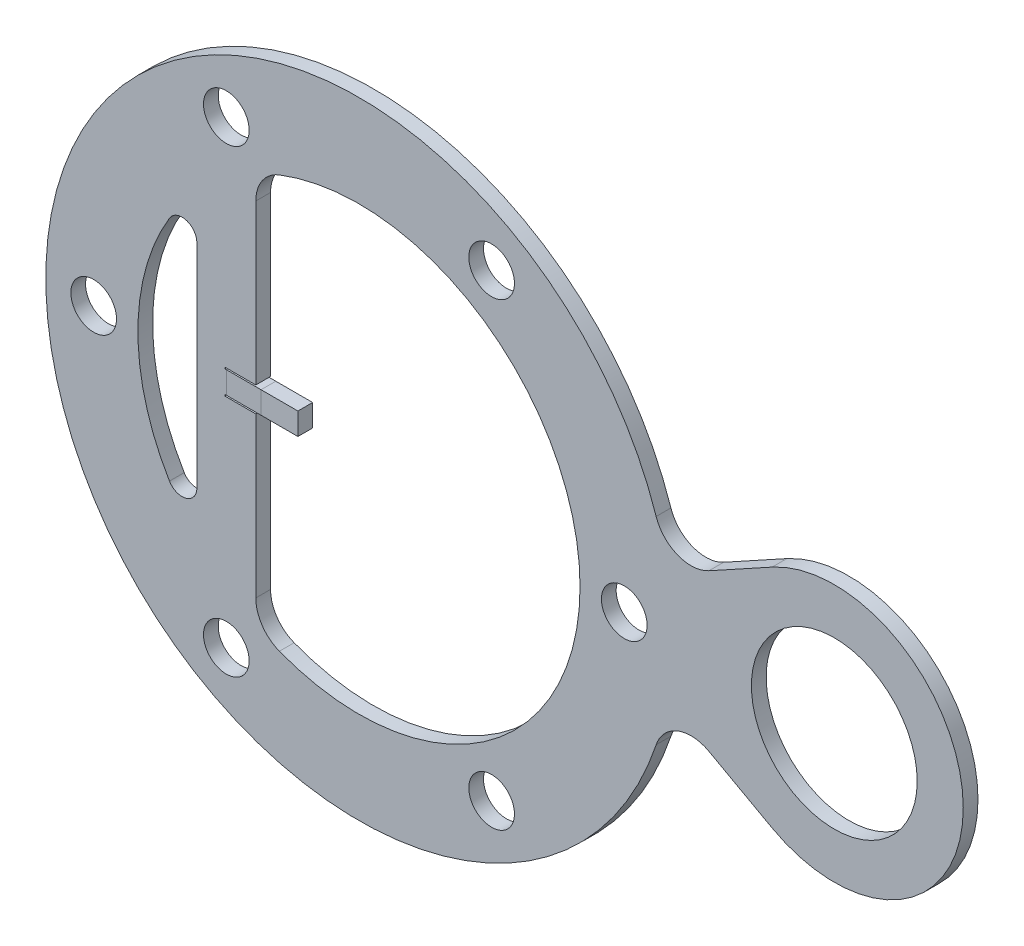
SolidWorks part; units mm, degrees
ref_plane "Plan1" through (0, 0, 0) normal (0, 0, 1) x (1, 0, 0)
ref_plane "Plan2" through (0, 0, 0) normal (0, 1, 0) x (1, 0, 0)
ref_plane "Plan3" through (0, 0, 0) normal (1, 0, 0) x (0, 0, -1)
sketch "Esquisse1" plane through (0, 0, 0) normal (0, 0, 1) x (1, 0, 0)
  line L0 (-17.0165, 10.6099) -> (-8.438, 15.3313)
  line L1 (-17.0165, -10.6099) -> (-8.438, -15.3313)
  line L2 (-64.5, 0) -> (0, 0) construction
  line L3 (-64.5, 0) -> (-82.5, 31.1769) construction
  line L4 (-64.5, 0) -> (-82.5, -31.1769) construction
  line L5 (-78.5, 23.3238) -> (-78.5, -23.3238)
  line L6 (-86.5, 14.4222) -> (-86.5, -14.4222)
  line L7 (-82.5, 31.1769) -> (-82.5, -31.1769) construction
  line L8 (-64.5, 8.641) -> (-64.5, -8.641) construction
  arc A0 (-8.438, -15.3313) -> (-8.438, 15.3313) centre (0, 0) ccw
  arc A1 (-24.1719, 13.4124) -> (-83.7667, -37.882) centre (-64.5, 0) ccw
  circle A2 centre (0, 0) radius 11.25
  circle A3 centre (-28.5, 0) radius 3.1
  arc A4 (-75.3, -27.9886) -> (-75.3, 27.9886) centre (-64.5, 0) ccw
  arc A5 (-17.0165, 10.6099) -> (-24.1719, 13.4124) centre (-19.4274, 14.9903) cw
  arc A6 (-24.1719, -13.4124) -> (-17.0165, -10.6099) centre (-19.4274, -14.9903) cw
  circle A7 centre (-64.5, 0) radius 36 construction
  circle A8 centre (-82.5, 31.1769) radius 3.1
  circle A9 centre (-82.5, -31.1769) radius 3.1
  arc A10 (-83.7667, -37.882) -> (-24.1719, -13.4124) centre (-64.5, 0) ccw
  arc A11 (-75.3, 27.9886) -> (-78.5, 23.3238) centre (-73.5, 23.3238) ccw
  arc A12 (-75.3, -27.9886) -> (-78.5, -23.3238) centre (-73.5, -23.3238) cw
  arc A13 (-86.5, 14.4222) -> (-90.2143, 15.4524) centre (-88.5, 14.4222) ccw
  arc A14 (-86.5, -14.4222) -> (-90.2143, -15.4524) centre (-88.5, -14.4222) cw
  circle A15 centre (-46.5, -31.1769) radius 3.1
  circle A16 centre (-46.5, 31.1769) radius 3.1
  arc A17 (-90.2143, 15.4524) -> (-90.2143, -15.4524) centre (-64.5, 0) ccw
  circle A18 centre (-100.5, 0) radius 3.1
  point P13 (-22.667, 7.5)
  point P16 (-22.667, -7.5)
  point P31 (-86.5, -36.3628)
  dimension "D1" = 35
  dimension "D2" = 22.5
  dimension "D3" = 85
  dimension "D4" = 6.2
  dimension "D8" = 60
  dimension "D9" = 5
  dimension "D11" = 5
  dimension "D13" = 2
  dimension "D5" = 28.5
  dimension "D6" = 15
  dimension "D7" = 64.5
  dimension "D10" = 120
  dimension "D12" = 8
extrude "Base-Extrusion" add sketch "Esquisse1" along normal blind 2
sketch "Esquisse2" plane through (0, 0, 2) normal (0, 0, 1) x (1, 0, 0)
  line L0 (-93.3693, 0) -> (-63.5087, 0) construction
  line L1 (-78.5, 23.3238) -> (-78.5, -23.3238) construction
  line L2 (-80.5, 1.5) -> (-78.5, 1.5)
  line L3 (-80.5, 1.5) -> (-80.5, -1.5)
  line L4 (-80.5, -1.5) -> (-78.5, -1.5)
  line L5 (-78.5, 1.5) -> (-78.5, -1.5)
  dimension "D1" = 3
  dimension "D2" = 2
extrude "Boss.-Extru.1" add sketch "Esquisse2" along normal blind 7
sheet metal parameters "Tôlerie 4" parameters "D1"=2
bend "Pli dans angle2" parameters "D1"=0
flatten bends "Dépliage 4" parameters "D1"=0, "D4"=90, "D5"=1
sketch "Esquisse-Angle4" plane through (0, 0, 2) normal (0, 0, 1) x (1, 0, 0)
  line L0 (-80.1438, -1.5) -> (-80.1438, 1.5) construction
process bends "Pliage 4"
sketch "Esquisse-Plate4" plane through (0, 0, 2) normal (0, 0, 1) x (1, 0, 0)
  dimension "D1" = 0
